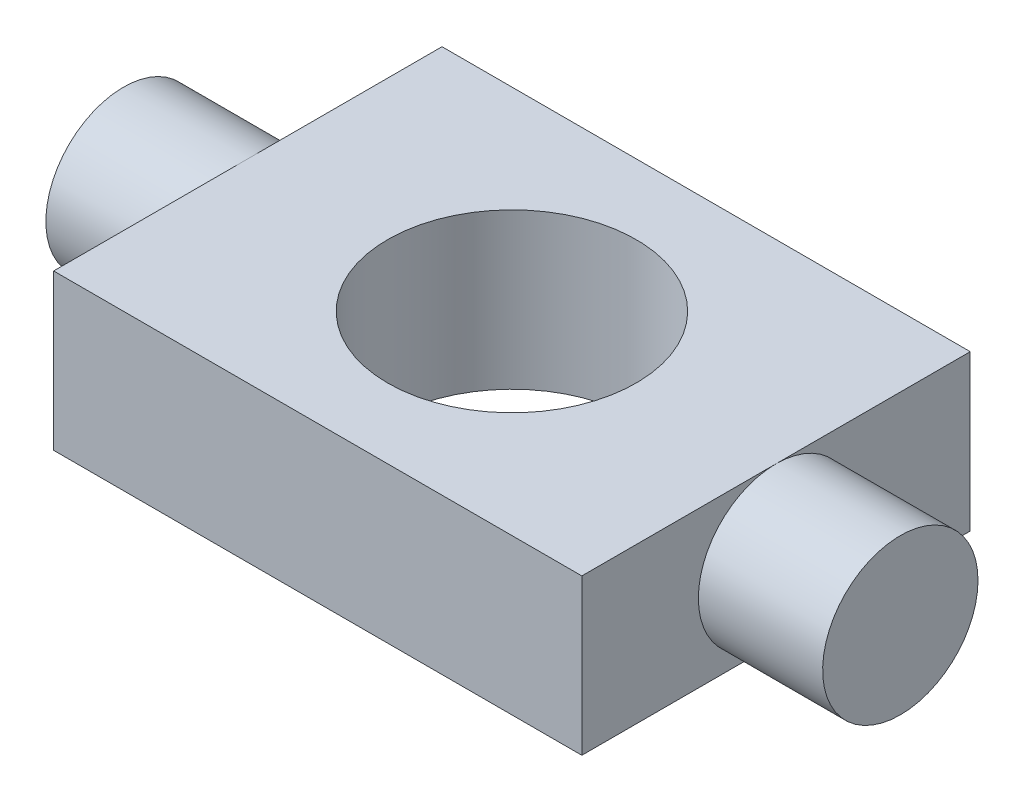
SolidWorks part; units mm, degrees
ref_plane "Face" through (0, 0, 0) normal (0, 0, 1) x (1, 0, 0)
ref_plane "Dessus" through (0, 0, 0) normal (0, 1, 0) x (1, 0, 0)
ref_plane "Droite" through (0, 0, 0) normal (1, 0, 0) x (0, 0, -1)
sketch "Esquisse1" plane through (0, 0, 0) normal (0, 0, 1) x (1, 0, 0)
  line L1 (0, 0) -> (34, 0)
  line L2 (0, 0) -> (0, 10)
  line L3 (0, 10) -> (34, 10)
  line L4 (34, 0) -> (34, 10)
  dimension "D1" = 34
  dimension "D2" = 10
extrude "Base-Extrusion" add sketch "Esquisse1" along normal blind 25
sketch "Esquisse2" plane through (0, 10, 0) normal (0, 1, 0) x (-1, 0, 0)
  line L0 (0, 0) -> (-34, 25) construction
  circle A0 centre (-17, 12.5) radius 8
  dimension "D1" = 16
extrude "Enlèv. mat.-Extru.1" cut sketch "Esquisse2" against normal through all
sketch "Esquisse3" plane through (34, 0, 0) normal (1, 0, 0) x (0, 0, -1)
  line L0 (-25, 10) -> (0, 0) construction
  circle A0 centre (-12.5, 5) radius 5
  dimension "D1" = 10
extrude "Boss.-Extru.1" add sketch "Esquisse3" along normal blind 8
sketch "Esquisse4" plane through (0, 10, 0) normal (0, 1, 0) x (-1, 0, 0)
  line L0 (-34, 25) -> (0, 25) construction
  point P0 (-17, 25)
ref_plane "Plan1" through (17, 0, 0) normal (1, 0, 0) x (0, 0, -1)
mirror "Symétrie1" about plane through (17, 0, 0) normal (1, 0, 0)
